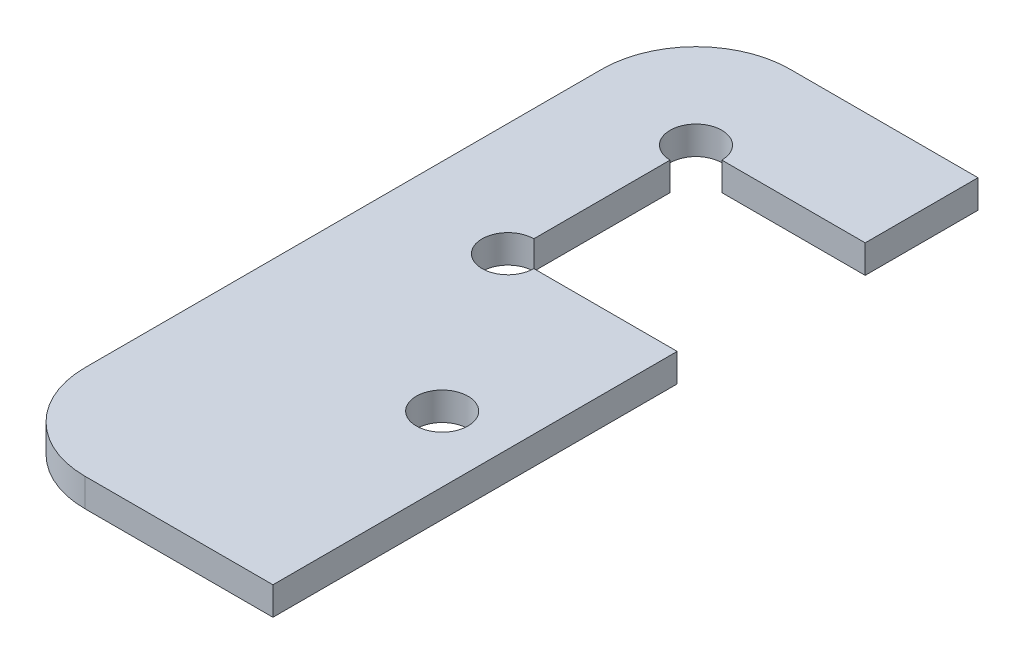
SolidWorks part; units mm, degrees
ref_plane "Front" through (0, 0, 0) normal (0, 0, 1) x (1, 0, 0)
ref_plane "Top" through (0, 0, 0) normal (0, 1, 0) x (1, 0, 0)
ref_plane "Right" through (0, 0, 0) normal (1, 0, 0) x (0, 0, -1)
sketch "Sketch1" plane through (0, 0, 0) normal (0, 1, 0) x (1, 0, 0)
  line L1 (10, 0) -> (30, 0)
  line L2 (0, 10) -> (0, 65)
  line L3 (10, 75) -> (30, 75)
  line L4 (30, 0) -> (30, 43)
  line L6 (12, 45.75) -> (12, 60.25)
  line L7 (30, 63) -> (30, 75)
  line L11 (14.75, 63) -> (30, 63)
  line L12 (14.75, 43) -> (30, 43)
  circle A0 centre (23, 25) radius 2.75
  arc A1 (14.75, 63) -> (12, 60.25) centre (12, 63) ccw
  arc A2 (12, 45.75) -> (14.75, 43) centre (12, 43) ccw
  arc A3 (0, 65) -> (10, 75) centre (10, 65) cw
  arc A4 (10, 0) -> (0, 10) centre (10, 10) cw
  point P11 (0, 0)
extrude "Extrude1" add sketch "Sketch1" along normal blind 3
